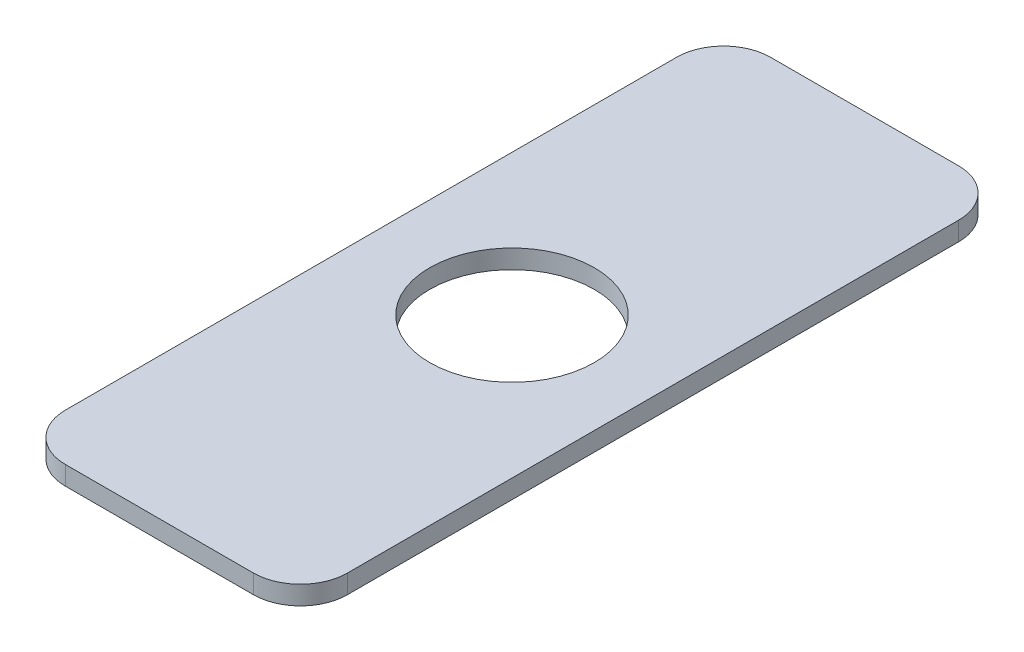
SolidWorks part; units mm, degrees
ref_plane "Front Plane" through (0, 0, 0) normal (0, 0, 1) x (1, 0, 0)
ref_plane "Top Plane" through (0, 0, 0) normal (0, 1, 0) x (1, 0, 0)
ref_plane "Right Plane" through (0, 0, 0) normal (1, 0, 0) x (0, 0, -1)
sketch "Sketch1" plane through (0, 0, 0) normal (0, 1, 0) x (1, 0, 0)
  line L1 (-30, 75) -> (30, 75)
  line L2 (-30, 75) -> (-30, -75)
  line L3 (-30, -75) -> (30, -75)
  line L4 (30, 75) -> (30, -75)
  line L5 (-30, 75) -> (30, -75) construction
  line L6 (-30, -75) -> (30, 75) construction
  point P0 (0, 0)
  dimension "D1" = 150
  dimension "D2" = 60
extrude "Boss-Extrude1" add sketch "Sketch1" along normal blind 4
fillet "Fillet1" radius 10 4 edges at (-30, 2, -75) (30, 2, -75) (30, 2, 75) (-30, 2, 75)
sketch "Sketch2" plane through (0, 4, 0) normal (0, 1, 0) x (1, 0, 0)
  circle A0 centre (0, 0) radius 17.5
  dimension "D1" = 35
extrude "Cut-Extrude1" cut sketch "Sketch2" against normal blind 4
